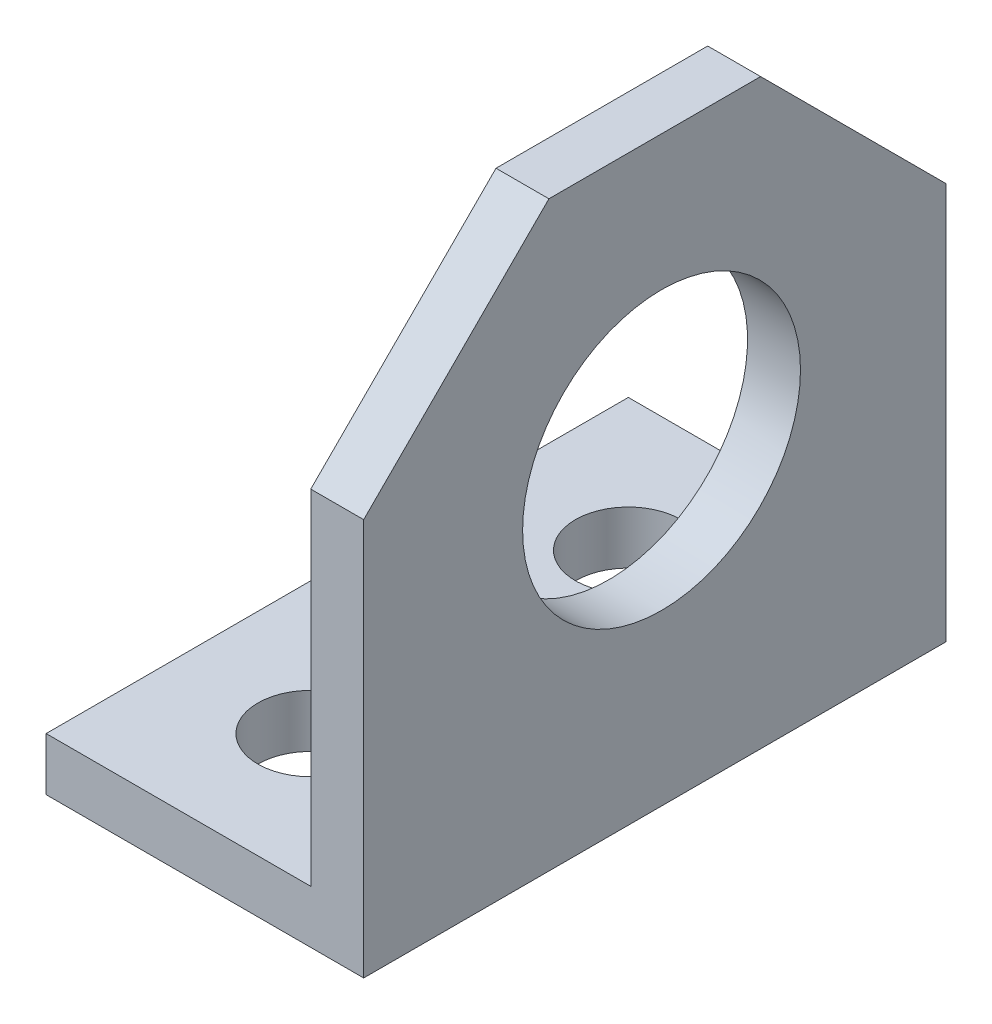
SolidWorks part; units mm, degrees
ref_plane "Plan de face" through (0, 0, 0) normal (0, 0, 1) x (1, 0, 0)
ref_plane "Plan de dessus" through (0, 0, 0) normal (0, 1, 0) x (1, 0, 0)
ref_plane "Plan de droite" through (0, 0, 0) normal (1, 0, 0) x (0, 0, -1)
sketch "Esquisse1" plane through (0, 0, 0) normal (0, 0, 1) x (1, 0, 0)
  line L0 (0, 0) -> (0, 22)
  line L1 (0, 0) -> (-12, 0)
  dimension "D1" = 22
  dimension "D2" = 12
extrude "Extru.-Mince1" add sketch "Esquisse1" along normal mid plane 22 thin
chamfer "Chanfrein1" distance 7 angle 45 2 edges at (-1, 22, -11) (-1, 22, 11)
sketch "Esquisse3" plane through (0, 0, 0) normal (1, 0, 0) x (0, 0, -1)
  line L0 (0, -2.6186) -> (0, 26.654) construction
sketch "Esquisse4" plane through (0, 2, 0) normal (0, 1, 0) x (1, 0, 0)
  line L0 (-12, -11) -> (-12, 11) construction
  line L1 (-2, 11) -> (-12, 11) construction
  line L2 (-2, -11) -> (-12, -11) construction
  circle A0 centre (-7, 6) radius 2
  circle A1 centre (-7, -6) radius 2
  point P8 (-7, -11)
  dimension "D2" = 4
  dimension "D1" = 5
  dimension "D4" = 5
  dimension "D5" = 5
extrude "Enlèv. mat.-Extru.2" cut sketch "Esquisse4" against normal blind 10.5
sketch "Esquisse5" plane through (-2, 0, 0) normal (-1, 0, 0) x (0, 0, 1)
  circle A0 centre (-0.2555, 11.6484) radius 5.25
  dimension "D1" = 10.5
  dimension "D2" = 0.2555
  dimension "D3" = 11.6484
extrude "Enlèv. mat.-Extru.3" cut sketch "Esquisse5" against normal blind 10
